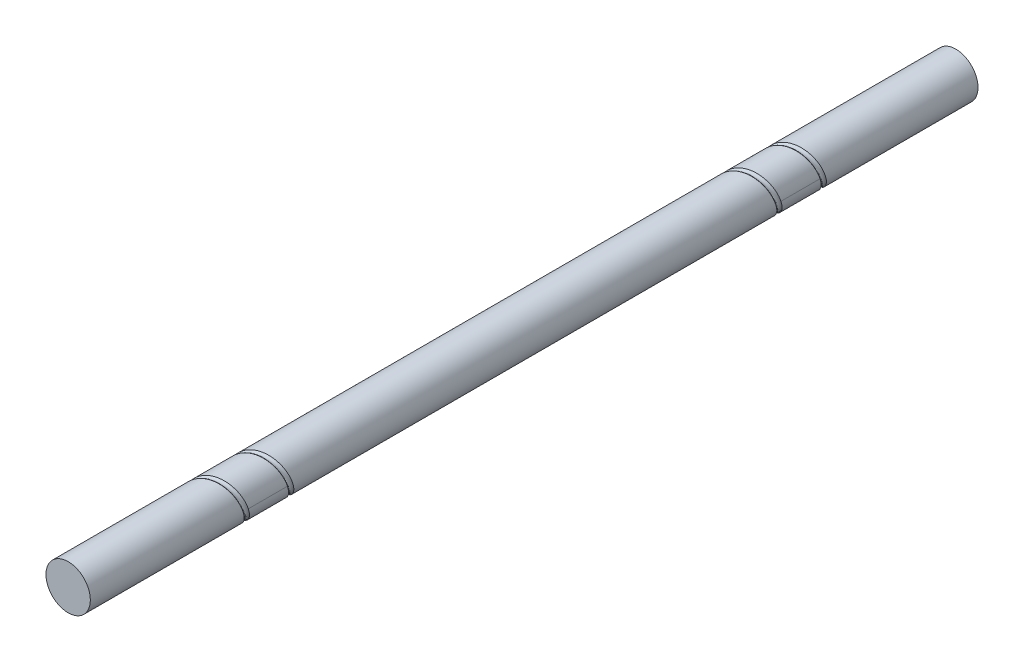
SolidWorks part; units mm, degrees
ref_plane "Front Plane" through (0, 0, 0) normal (0, 0, 1) x (1, 0, 0)
ref_plane "Top Plane" through (0, 0, 0) normal (0, 1, 0) x (1, 0, 0)
ref_plane "Right Plane" through (0, 0, 0) normal (1, 0, 0) x (0, 0, -1)
sketch "Sketch1" plane through (0, 0, 0) normal (0, 0, 1) x (1, 0, 0)
  circle A0 centre (0, 0) radius 25
  dimension "D1" = 50
extrude "Boss-Extrude1" add sketch "Sketch1" along normal blind 1000
ref_plane "Plane1" through (0, 0, 150) normal (0, 0, 1) x (1, 0, 0)
sketch "Sketch2" plane through (0, 0, 150) normal (0, 0, 1) x (1, 0, 0)
  circle A0 centre (0, 0) radius 27.646
  dimension "D1" = 55.292
curve "Helix/Spiral1"
sketch "Sketch3" plane through (0, 0, 0) normal (0, 1, 0) x (1, 0, 0)
  circle A0 centre (-27.646, -150) radius 3.969
  spline S0 degree 3 poles (-27.646, -150) (-27.646, -150.7073) (-26.9833, -152.1286) (-24.0718, -154.2551) (-19.4496, -156.383) (-13.4454, -158.5106) (-6.4857, -160.6383) (0.9349, -162.766) (8.289, -164.8936) (15.0541, -167.0213) (20.7495, -169.1489) (24.9703, -171.2766) (27.4167, -173.4043) (27.9149, -175.5319) (26.4293, -177.6596) (23.0657, -179.7872) (18.063, -181.9149) (11.7766, -184.0426) (4.6535, -186.1702) (-2.8004, -188.2979) (-10.0553, -190.4255) (-16.5956, -192.5532) (-21.9566, -194.6809) (-25.7573, -196.8085) (-27.7277, -198.9362) (-27.7277, -201.0638) (-25.7573, -203.1915) (-21.9566, -205.3191) (-16.5956, -207.4468) (-10.0553, -209.5745) (-2.8004, -211.7021) (4.6535, -213.8298) (11.7766, -215.9574) (18.063, -218.0851) (23.0657, -220.2128) (26.4293, -222.3404) (27.9149, -224.4681) (27.4167, -226.5957) (24.9703, -228.7234) (20.7495, -230.8511) (15.0541, -232.9787) (8.289, -235.1064) (0.9349, -237.234) (-6.4857, -239.3617) (-13.4454, -241.4894) (-19.4496, -243.617) (-24.0718, -245.7449) (-26.9833, -247.8714) (-27.646, -249.2927) (-27.646, -250) knots 0 0 0 0 0.021277 0.042553 0.06383 0.085106 0.106383 0.12766 0.148936 0.170213 0.191489 0.212766 0.234043 0.255319 0.276596 0.297872 0.319149 0.340426 0.361702 0.382979 0.404255 0.425532 0.446809 0.468085 0.489362 0.510638 0.531915 0.553191 0.574468 0.595745 0.617021 0.638298 0.659574 0.680851 0.702128 0.723404 0.744681 0.765957 0.787234 0.808511 0.829787 0.851064 0.87234 0.893617 0.914894 0.93617 0.957447 0.978723 1 1 1 1 construction
  dimension "D1" = 7.938
sweep "Cut-Sweep1" cut profiles "Sketch3" path "Helix/Spiral1"
pattern_linear "LPattern1" count 2 spacing 600 along (0, 0, -1) of "Cut-Sweep1"
